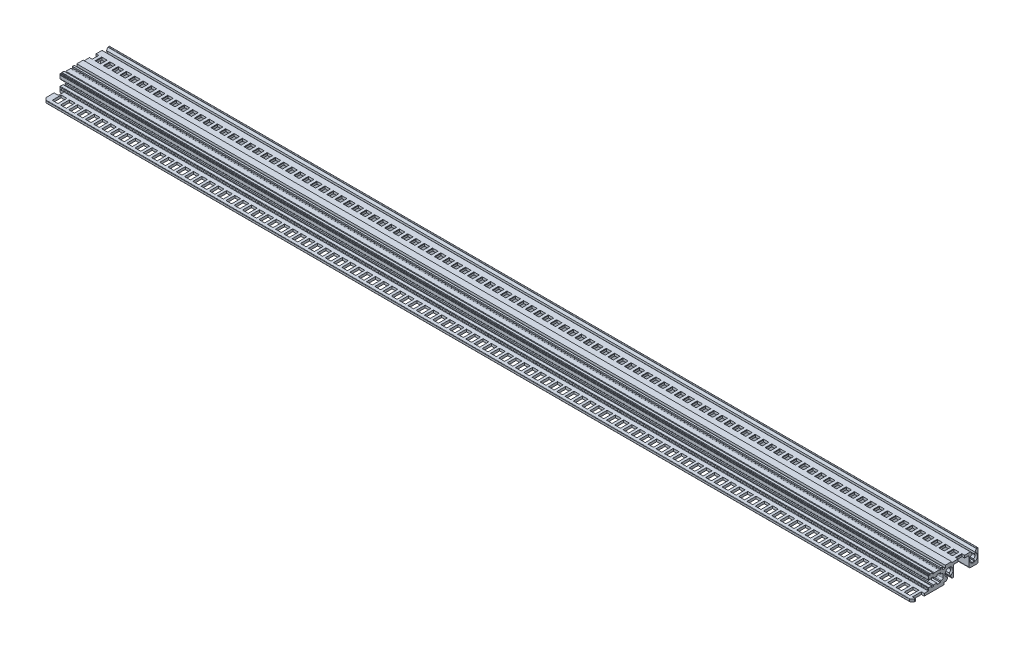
SolidWorks part; units mm, degrees
other "1"
ref_plane "前视基准面" through (0, 0, 0) normal (0, 0, 1) x (1, 0, 0)
ref_plane "上视基准面" through (0, 0, 0) normal (0, 1, 0) x (1, 0, 0)
ref_plane "右视基准面" through (0, 0, 0) normal (1, 0, 0) x (0, 0, -1)
imported_body "输入1"
sketch "草图1" plane through (215.9, 0, 0) normal (1, 0, 0) x (0, 0, -1)
  line L1 (-32.3698, 5.0331) -> (15.5626, 5.0331)
  line L2 (-32.3698, 5.0331) -> (-32.3698, -10.6403)
  line L3 (-32.3698, -10.6403) -> (15.5626, -10.6403)
  line L4 (15.5626, 5.0331) -> (15.5626, -10.6403)
extrude "切除-拉伸1" cut sketch "草图1" against normal up to surface (42.39 mm away)
sketch "草图2" plane through (173.51, 0, 0) normal (1, 0, 0) x (0, 0, -1)
  line L75 (-20.35, -7.9) -> (-30.05, -7.9)
  line L76 (-30.25, -8.1) -> (-30.25, -9.2)
  line L77 (-30.05, -9.4) -> (-10.9, -9.4)
  line L78 (-10.7, -9.2) -> (-10.7, -8.1)
  line L79 (-10.7, -8.1) -> (-9.2333, -8.1)
  line L80 (-9.0601, -8) -> (-8.425, -6.9)
  line L81 (-8.425, -6.9) -> (-8.425, -5.0408)
  line L82 (-8.425, -3.3592) -> (-8.425, -2.5571)
  line L83 (-8.075, -1.7) -> (-6.925, -1.7)
  line L84 (-6.575, -2.5571) -> (-6.575, -3.3592)
  line L85 (-6.575, -5.0408) -> (-6.575, -6.9)
  line L86 (-6.575, -6.9) -> (-5.7667, -8.3)
  line L87 (-5.5935, -8.4) -> (-4.95, -8.4)
  line L88 (-4.75, -8.2) -> (-4.75, -2.3)
  line L89 (-3.95, -1.5) -> (3.95, -1.5)
  line L90 (4.75, -2.3) -> (4.75, -7.6)
  line L91 (5.55, -8.4) -> (9.45, -8.4)
  line L92 (10.25, -7.6) -> (10.25, -0.2)
  line L93 (10.05, 0) -> (9.4065, 0)
  line L94 (9.2333, -0.1) -> (8.425, -1.5)
  line L95 (8.425, -1.5) -> (8.425, -3.3592)
  line L96 (8.425, -5.0408) -> (8.425, -6.2)
  line L97 (8.225, -6.4) -> (6.775, -6.4)
  line L98 (6.575, -6.2) -> (6.575, -5.0408)
  line L99 (6.575, -3.3592) -> (6.575, -1.5)
  line L100 (6.575, -1.5) -> (5.7667, -0.1)
  line L101 (5.5935, 0) -> (-5.95, 0)
  line L102 (-5.95, 0) -> (-5.95, 0.6)
  line L103 (-5.95, 0.6) -> (-9.85, 0.6)
  line L104 (-9.85, 0.6) -> (-9.85, -0.8)
  line L105 (-10.05, -1) -> (-11.25, -1)
  line L106 (-11.45, -0.8) -> (-11.45, 0.6)
  line L107 (-11.45, 0.6) -> (-12.5, 0.6)
  line L108 (-12.5, 0.6) -> (-12.5, -0.1)
  line L109 (-12.7, -0.3) -> (-13.3, -0.3)
  line L110 (-13.6873, 0) -> (-16.5127, 0)
  line L111 (-16.9, -0.3) -> (-17.5, -0.3)
  line L112 (-17.7, -0.1) -> (-17.7, 0.6)
  line L113 (-17.7, 0.6) -> (-18.95, 0.6)
  line L114 (-19.15, 0.4) -> (-19.15, 0.1)
  line L115 (-19.35, -0.1) -> (-19.45, -0.1)
  line L116 (-19.65, 0.1) -> (-19.65, 0.2)
  line L117 (-19.85, 0.4) -> (-19.95, 0.4)
  line L118 (-20.15, 0.2) -> (-20.15, 0.0328)
  line L119 (-20.2086, -0.1086) -> (-20.25, -0.15)
  line L120 (-20.25, -0.15) -> (-20.25, -1.95)
  line L121 (-20.25, -1.95) -> (-20.2086, -1.9914)
  line L122 (-20.15, -2.1328) -> (-20.15, -2.3)
  line L123 (-19.95, -2.5) -> (-19.85, -2.5)
  line L124 (-19.65, -2.3) -> (-19.65, -2.2)
  line L125 (-19.45, -2) -> (-19.2328, -2)
  line L126 (-19.0914, -2.0586) -> (-18.5086, -2.6414)
  line L127 (-18.3672, -2.7) -> (-18.25, -2.7)
  line L128 (-18.25, -2.7) -> (-18.25, -1.85)
  line L129 (-18.25, -1.85) -> (-17.05, -1.85)
  line L130 (-17.05, -1.85) -> (-17.05, -2.7)
  line L131 (-17.05, -2.7) -> (-15.05, -2.7)
  line L132 (-15.05, -2.7) -> (-15.05, -1.85)
  line L133 (-15.05, -1.85) -> (-12.85, -1.85)
  line L134 (-12.85, -1.85) -> (-12.85, -2.7)
  line L135 (-12.85, -2.7) -> (-12.05, -2.7)
  line L136 (-11.25, -3.5) -> (-11.25, -5.45)
  line L137 (-12.05, -6.25) -> (-12.85, -6.25)
  line L138 (-12.85, -6.25) -> (-12.85, -7.1)
  line L139 (-12.85, -7.1) -> (-15.05, -7.1)
  line L140 (-15.05, -7.1) -> (-15.05, -6.25)
  line L141 (-15.05, -6.25) -> (-17.05, -6.25)
  line L142 (-17.05, -6.25) -> (-17.05, -7.1)
  line L143 (-17.05, -7.1) -> (-18.25, -7.1)
  line L144 (-18.25, -7.1) -> (-18.25, -6.25)
  line L145 (-18.25, -6.25) -> (-19.9587, -6.25)
  line L146 (-20.2086, -6.5086) -> (-20.25, -6.55)
  line L147 (-20.25, -6.55) -> (-20.25, -7.28)
  line L148 (-20.25, -7.28) -> (-20.2086, -7.3214)
  line L149 (-20.15, -7.4628) -> (-20.15, -7.7)
  line L150 (-20.35, -7.9) -> (-30.05, -7.9)
  line L151 (-30.25, -8.1) -> (-30.25, -9.2)
  line L152 (-30.05, -9.4) -> (-10.9, -9.4)
  line L153 (-10.7, -9.2) -> (-10.7, -8.1)
  line L154 (-10.7, -8.1) -> (-9.2333, -8.1)
  line L155 (-9.0601, -8) -> (-8.425, -6.9)
  line L156 (-8.425, -6.9) -> (-8.425, -5.0408)
  line L157 (-8.425, -3.3592) -> (-8.425, -2.5571)
  line L158 (-8.075, -1.7) -> (-6.925, -1.7)
  line L159 (-6.575, -2.5571) -> (-6.575, -3.3592)
  line L160 (-6.575, -5.0408) -> (-6.575, -6.9)
  line L161 (-6.575, -6.9) -> (-5.7667, -8.3)
  line L162 (-5.5935, -8.4) -> (-4.95, -8.4)
  line L163 (-4.75, -8.2) -> (-4.75, -2.3)
  line L164 (-3.95, -1.5) -> (3.95, -1.5)
  line L165 (4.75, -2.3) -> (4.75, -7.6)
  line L166 (5.55, -8.4) -> (9.45, -8.4)
  line L167 (10.25, -7.6) -> (10.25, -0.2)
  line L168 (10.05, 0) -> (9.4065, 0)
  line L169 (9.2333, -0.1) -> (8.425, -1.5)
  line L170 (8.425, -1.5) -> (8.425, -3.3592)
  line L171 (8.425, -5.0408) -> (8.425, -6.2)
  line L172 (8.225, -6.4) -> (6.775, -6.4)
  line L173 (6.575, -6.2) -> (6.575, -5.0408)
  line L174 (6.575, -3.3592) -> (6.575, -1.5)
  line L175 (6.575, -1.5) -> (5.7667, -0.1)
  line L176 (5.5935, 0) -> (-5.95, 0)
  line L177 (-5.95, 0) -> (-5.95, 0.6)
  line L178 (-5.95, 0.6) -> (-9.85, 0.6)
  line L179 (-9.85, 0.6) -> (-9.85, -0.8)
  line L180 (-10.05, -1) -> (-11.25, -1)
  line L181 (-11.45, -0.8) -> (-11.45, 0.6)
  line L182 (-11.45, 0.6) -> (-12.5, 0.6)
  line L183 (-12.5, 0.6) -> (-12.5, -0.1)
  line L184 (-12.7, -0.3) -> (-13.3, -0.3)
  line L185 (-13.6873, 0) -> (-16.5127, 0)
  line L186 (-16.9, -0.3) -> (-17.5, -0.3)
  line L187 (-17.7, -0.1) -> (-17.7, 0.6)
  line L188 (-17.7, 0.6) -> (-18.95, 0.6)
  line L189 (-19.15, 0.4) -> (-19.15, 0.1)
  line L190 (-19.35, -0.1) -> (-19.45, -0.1)
  line L191 (-19.65, 0.1) -> (-19.65, 0.2)
  line L192 (-19.85, 0.4) -> (-19.95, 0.4)
  line L193 (-20.15, 0.2) -> (-20.15, 0.0328)
  line L194 (-20.2086, -0.1086) -> (-20.25, -0.15)
  line L195 (-20.25, -0.15) -> (-20.25, -1.95)
  line L196 (-20.25, -1.95) -> (-20.2086, -1.9914)
  line L197 (-20.15, -2.1328) -> (-20.15, -2.3)
  line L198 (-19.95, -2.5) -> (-19.85, -2.5)
  line L199 (-19.65, -2.3) -> (-19.65, -2.2)
  line L200 (-19.45, -2) -> (-19.2328, -2)
  line L201 (-19.0914, -2.0586) -> (-18.5086, -2.6414)
  line L202 (-18.3672, -2.7) -> (-18.25, -2.7)
  line L203 (-18.25, -2.7) -> (-18.25, -1.85)
  line L204 (-18.25, -1.85) -> (-17.05, -1.85)
  line L205 (-17.05, -1.85) -> (-17.05, -2.7)
  line L206 (-17.05, -2.7) -> (-15.05, -2.7)
  line L207 (-15.05, -2.7) -> (-15.05, -1.85)
  line L208 (-15.05, -1.85) -> (-12.85, -1.85)
  line L209 (-12.85, -1.85) -> (-12.85, -2.7)
  line L210 (-12.85, -2.7) -> (-12.05, -2.7)
  line L211 (-11.25, -3.5) -> (-11.25, -5.45)
  line L212 (-12.05, -6.25) -> (-12.85, -6.25)
  line L213 (-12.85, -6.25) -> (-12.85, -7.1)
  line L214 (-12.85, -7.1) -> (-15.05, -7.1)
  line L215 (-15.05, -7.1) -> (-15.05, -6.25)
  line L216 (-15.05, -6.25) -> (-17.05, -6.25)
  line L217 (-17.05, -6.25) -> (-17.05, -7.1)
  line L218 (-17.05, -7.1) -> (-18.25, -7.1)
  line L219 (-18.25, -7.1) -> (-18.25, -6.25)
  line L220 (-18.25, -6.25) -> (-19.9587, -6.25)
  line L221 (-20.2086, -6.5086) -> (-20.25, -6.55)
  line L222 (-20.25, -6.55) -> (-20.25, -7.28)
  line L223 (-20.25, -7.28) -> (-20.2086, -7.3214)
  line L224 (-20.15, -7.4628) -> (-20.15, -7.7)
  arc A47 (-30.05, -7.9) -> (-30.25, -8.1) centre (-30.05, -8.1) ccw
  arc A48 (-30.25, -9.2) -> (-30.05, -9.4) centre (-30.05, -9.2) ccw
  arc A49 (-10.9, -9.4) -> (-10.7, -9.2) centre (-10.9, -9.2) ccw
  arc A50 (-9.2333, -8.1) -> (-9.0601, -8) centre (-9.2333, -7.9) ccw
  arc A51 (-8.425, -3.3592) -> (-8.425, -5.0408) centre (-7.5, -4.2) ccw
  arc A52 (-8.075, -1.7) -> (-8.425, -2.5571) centre (-8.075, -2.2) ccw
  arc A53 (-6.575, -2.5571) -> (-6.925, -1.7) centre (-6.925, -2.2) ccw
  arc A54 (-6.575, -5.0408) -> (-6.575, -3.3592) centre (-7.5, -4.2) ccw
  arc A55 (-5.7667, -8.3) -> (-5.5935, -8.4) centre (-5.5935, -8.2) ccw
  arc A56 (-4.95, -8.4) -> (-4.75, -8.2) centre (-4.95, -8.2) ccw
  arc A57 (-3.95, -1.5) -> (-4.75, -2.3) centre (-3.95, -2.3) ccw
  arc A58 (4.75, -2.3) -> (3.95, -1.5) centre (3.95, -2.3) ccw
  arc A59 (4.75, -7.6) -> (5.55, -8.4) centre (5.55, -7.6) ccw
  arc A60 (9.45, -8.4) -> (10.25, -7.6) centre (9.45, -7.6) ccw
  arc A61 (10.25, -0.2) -> (10.05, 0) centre (10.05, -0.2) ccw
  arc A62 (9.4065, 0) -> (9.2333, -0.1) centre (9.4065, -0.2) ccw
  arc A63 (8.425, -5.0408) -> (8.425, -3.3592) centre (7.5, -4.2) ccw
  arc A64 (8.225, -6.4) -> (8.425, -6.2) centre (8.225, -6.2) ccw
  arc A65 (6.575, -6.2) -> (6.775, -6.4) centre (6.775, -6.2) ccw
  arc A66 (6.575, -3.3592) -> (6.575, -5.0408) centre (7.5, -4.2) ccw
  arc A67 (5.7667, -0.1) -> (5.5935, 0) centre (5.5935, -0.2) ccw
  arc A68 (-10.05, -1) -> (-9.85, -0.8) centre (-10.05, -0.8) ccw
  arc A69 (-11.45, -0.8) -> (-11.25, -1) centre (-11.25, -0.8) ccw
  arc A70 (-12.7, -0.3) -> (-12.5, -0.1) centre (-12.7, -0.1) ccw
  arc A71 (-13.4936, -0.15) -> (-13.3, -0.3) centre (-13.3, -0.1) ccw
  arc A72 (-13.4936, -0.15) -> (-13.6873, 0) centre (-13.6873, -0.2) ccw
  arc A73 (-16.5127, 0) -> (-16.7064, -0.15) centre (-16.5127, -0.2) ccw
  arc A74 (-16.9, -0.3) -> (-16.7064, -0.15) centre (-16.9, -0.1) ccw
  arc A75 (-17.7, -0.1) -> (-17.5, -0.3) centre (-17.5, -0.1) ccw
  arc A76 (-18.95, 0.6) -> (-19.15, 0.4) centre (-18.95, 0.4) ccw
  arc A77 (-19.35, -0.1) -> (-19.15, 0.1) centre (-19.35, 0.1) ccw
  arc A78 (-19.65, 0.1) -> (-19.45, -0.1) centre (-19.45, 0.1) ccw
  arc A79 (-19.65, 0.2) -> (-19.85, 0.4) centre (-19.85, 0.2) ccw
  arc A80 (-19.95, 0.4) -> (-20.15, 0.2) centre (-19.95, 0.2) ccw
  arc A81 (-20.2086, -0.1086) -> (-20.15, 0.0328) centre (-20.35, 0.0328) ccw
  arc A82 (-20.15, -2.1328) -> (-20.2086, -1.9914) centre (-20.35, -2.1328) ccw
  arc A83 (-20.15, -2.3) -> (-19.95, -2.5) centre (-19.95, -2.3) ccw
  arc A84 (-19.85, -2.5) -> (-19.65, -2.3) centre (-19.85, -2.3) ccw
  arc A85 (-19.45, -2) -> (-19.65, -2.2) centre (-19.45, -2.2) ccw
  arc A86 (-19.0914, -2.0586) -> (-19.2328, -2) centre (-19.2328, -2.2) ccw
  arc A87 (-18.5086, -2.6414) -> (-18.3672, -2.7) centre (-18.3672, -2.5) ccw
  arc A88 (-11.25, -3.5) -> (-12.05, -2.7) centre (-12.05, -3.5) ccw
  arc A89 (-12.05, -6.25) -> (-11.25, -5.45) centre (-12.05, -5.45) ccw
  arc A90 (-19.9587, -6.25) -> (-20.1543, -6.4086) centre (-19.9587, -6.45) ccw
  arc A91 (-20.2086, -6.5086) -> (-20.1543, -6.4086) centre (-20.35, -6.3672) ccw
  arc A92 (-20.15, -7.4628) -> (-20.2086, -7.3214) centre (-20.35, -7.4628) ccw
  arc A93 (-20.35, -7.9) -> (-20.15, -7.7) centre (-20.35, -7.7) ccw
  arc A94 (-30.05, -7.9) -> (-30.25, -8.1) centre (-30.05, -8.1) ccw
  arc A95 (-30.25, -9.2) -> (-30.05, -9.4) centre (-30.05, -9.2) ccw
  arc A96 (-10.9, -9.4) -> (-10.7, -9.2) centre (-10.9, -9.2) ccw
  arc A97 (-9.2333, -8.1) -> (-9.0601, -8) centre (-9.2333, -7.9) ccw
  arc A98 (-8.425, -3.3592) -> (-8.425, -5.0408) centre (-7.5, -4.2) ccw
  arc A99 (-8.075, -1.7) -> (-8.425, -2.5571) centre (-8.075, -2.2) ccw
  arc A100 (-6.575, -2.5571) -> (-6.925, -1.7) centre (-6.925, -2.2) ccw
  arc A101 (-6.575, -5.0408) -> (-6.575, -3.3592) centre (-7.5, -4.2) ccw
  arc A102 (-5.7667, -8.3) -> (-5.5935, -8.4) centre (-5.5935, -8.2) ccw
  arc A103 (-4.95, -8.4) -> (-4.75, -8.2) centre (-4.95, -8.2) ccw
  arc A104 (-3.95, -1.5) -> (-4.75, -2.3) centre (-3.95, -2.3) ccw
  arc A105 (4.75, -2.3) -> (3.95, -1.5) centre (3.95, -2.3) ccw
  arc A106 (4.75, -7.6) -> (5.55, -8.4) centre (5.55, -7.6) ccw
  arc A107 (9.45, -8.4) -> (10.25, -7.6) centre (9.45, -7.6) ccw
  arc A108 (10.25, -0.2) -> (10.05, 0) centre (10.05, -0.2) ccw
  arc A109 (9.4065, 0) -> (9.2333, -0.1) centre (9.4065, -0.2) ccw
  arc A110 (8.425, -5.0408) -> (8.425, -3.3592) centre (7.5, -4.2) ccw
  arc A111 (8.225, -6.4) -> (8.425, -6.2) centre (8.225, -6.2) ccw
  arc A112 (6.575, -6.2) -> (6.775, -6.4) centre (6.775, -6.2) ccw
  arc A113 (6.575, -3.3592) -> (6.575, -5.0408) centre (7.5, -4.2) ccw
  arc A114 (5.7667, -0.1) -> (5.5935, 0) centre (5.5935, -0.2) ccw
  arc A115 (-10.05, -1) -> (-9.85, -0.8) centre (-10.05, -0.8) ccw
  arc A116 (-11.45, -0.8) -> (-11.25, -1) centre (-11.25, -0.8) ccw
  arc A117 (-12.7, -0.3) -> (-12.5, -0.1) centre (-12.7, -0.1) ccw
  arc A118 (-13.4936, -0.15) -> (-13.3, -0.3) centre (-13.3, -0.1) ccw
  arc A119 (-13.4936, -0.15) -> (-13.6873, 0) centre (-13.6873, -0.2) ccw
  arc A120 (-16.5127, 0) -> (-16.7064, -0.15) centre (-16.5127, -0.2) ccw
  arc A121 (-16.9, -0.3) -> (-16.7064, -0.15) centre (-16.9, -0.1) ccw
  arc A122 (-17.7, -0.1) -> (-17.5, -0.3) centre (-17.5, -0.1) ccw
  arc A123 (-18.95, 0.6) -> (-19.15, 0.4) centre (-18.95, 0.4) ccw
  arc A124 (-19.35, -0.1) -> (-19.15, 0.1) centre (-19.35, 0.1) ccw
  arc A125 (-19.65, 0.1) -> (-19.45, -0.1) centre (-19.45, 0.1) ccw
  arc A126 (-19.65, 0.2) -> (-19.85, 0.4) centre (-19.85, 0.2) ccw
  arc A127 (-19.95, 0.4) -> (-20.15, 0.2) centre (-19.95, 0.2) ccw
  arc A128 (-20.2086, -0.1086) -> (-20.15, 0.0328) centre (-20.35, 0.0328) ccw
  arc A129 (-20.15, -2.1328) -> (-20.2086, -1.9914) centre (-20.35, -2.1328) ccw
  arc A130 (-20.15, -2.3) -> (-19.95, -2.5) centre (-19.95, -2.3) ccw
  arc A131 (-19.85, -2.5) -> (-19.65, -2.3) centre (-19.85, -2.3) ccw
  arc A132 (-19.45, -2) -> (-19.65, -2.2) centre (-19.45, -2.2) ccw
  arc A133 (-19.0914, -2.0586) -> (-19.2328, -2) centre (-19.2328, -2.2) ccw
  arc A134 (-18.5086, -2.6414) -> (-18.3672, -2.7) centre (-18.3672, -2.5) ccw
  arc A135 (-11.25, -3.5) -> (-12.05, -2.7) centre (-12.05, -3.5) ccw
  arc A136 (-12.05, -6.25) -> (-11.25, -5.45) centre (-12.05, -5.45) ccw
  arc A137 (-19.9587, -6.25) -> (-20.1543, -6.4086) centre (-19.9587, -6.45) ccw
  arc A138 (-20.2086, -6.5086) -> (-20.1543, -6.4086) centre (-20.35, -6.3672) ccw
  arc A139 (-20.15, -7.4628) -> (-20.2086, -7.3214) centre (-20.35, -7.4628) ccw
  arc A140 (-20.35, -7.9) -> (-20.15, -7.7) centre (-20.35, -7.7) ccw
  dimension "D1" = 0
extrude "凸台-拉伸1" add sketch "草图2" along normal blind 143.99
sketch "草图3" plane through (317.5, 0, 0) normal (1, 0, 0) x (0, 0, -1)
  circle A0 centre (-7.5, -4.2) radius 1.65
  circle A1 centre (7.5, -4.2) radius 1.65
extrude "切除-拉伸2" cut sketch "草图3" against normal blind 15.02
chamfer "倒角1" distance 0.85 angle 45 3 edges at (317.5, -4.2, -5.85) (317.5, -4.2, 5.85) (317.5, -4.2, 9.15)
sketch "草图4" plane through (0, -7.9, 0) normal (0, 1, 0) x (1, 0, 0)
  line L1 (173.51, -22.75) -> (177.01, -22.75)
  line L2 (173.51, -22.75) -> (173.51, -28.25)
  line L3 (173.51, -28.25) -> (177.01, -28.25)
  line L4 (177.01, -22.75) -> (177.01, -28.25)
  line L6 (171.93, -22.75) -> (171.93, -28.25) construction
  line L8 (178.59, -28.25) -> (182.09, -28.25)
  line L9 (178.59, -22.75) -> (178.59, -28.25)
  line L10 (178.59, -22.75) -> (182.09, -22.75)
  line L11 (182.09, -22.75) -> (182.09, -28.25)
  line L12 (183.67, -28.25) -> (187.17, -28.25)
  line L13 (183.67, -22.75) -> (183.67, -28.25)
  line L14 (183.67, -22.75) -> (187.17, -22.75)
  line L15 (187.17, -22.75) -> (187.17, -28.25)
  line L16 (188.75, -28.25) -> (192.25, -28.25)
  line L17 (188.75, -22.75) -> (188.75, -28.25)
  line L18 (188.75, -22.75) -> (192.25, -22.75)
  line L19 (192.25, -22.75) -> (192.25, -28.25)
  line L20 (193.83, -28.25) -> (197.33, -28.25)
  line L21 (193.83, -22.75) -> (193.83, -28.25)
  line L22 (193.83, -22.75) -> (197.33, -22.75)
  line L23 (197.33, -22.75) -> (197.33, -28.25)
  line L24 (198.91, -28.25) -> (202.41, -28.25)
  line L25 (198.91, -22.75) -> (198.91, -28.25)
  line L26 (198.91, -22.75) -> (202.41, -22.75)
  line L27 (202.41, -22.75) -> (202.41, -28.25)
  line L28 (203.99, -28.25) -> (207.49, -28.25)
  line L29 (203.99, -22.75) -> (203.99, -28.25)
  line L30 (203.99, -22.75) -> (207.49, -22.75)
  line L31 (207.49, -22.75) -> (207.49, -28.25)
  line L32 (209.07, -28.25) -> (212.57, -28.25)
  line L33 (209.07, -22.75) -> (209.07, -28.25)
  line L34 (209.07, -22.75) -> (212.57, -22.75)
  line L35 (212.57, -22.75) -> (212.57, -28.25)
  line L36 (214.15, -28.25) -> (217.65, -28.25)
  line L37 (214.15, -22.75) -> (214.15, -28.25)
  line L38 (214.15, -22.75) -> (217.65, -22.75)
  line L39 (217.65, -22.75) -> (217.65, -28.25)
  line L40 (219.23, -28.25) -> (222.73, -28.25)
  line L41 (219.23, -22.75) -> (219.23, -28.25)
  line L42 (219.23, -22.75) -> (222.73, -22.75)
  line L43 (222.73, -22.75) -> (222.73, -28.25)
  line L44 (224.31, -28.25) -> (227.81, -28.25)
  line L45 (224.31, -22.75) -> (224.31, -28.25)
  line L46 (224.31, -22.75) -> (227.81, -22.75)
  line L47 (227.81, -22.75) -> (227.81, -28.25)
  line L48 (229.39, -28.25) -> (232.89, -28.25)
  line L49 (229.39, -22.75) -> (229.39, -28.25)
  line L50 (229.39, -22.75) -> (232.89, -22.75)
  line L51 (232.89, -22.75) -> (232.89, -28.25)
  line L52 (234.47, -28.25) -> (237.97, -28.25)
  line L53 (234.47, -22.75) -> (234.47, -28.25)
  line L54 (234.47, -22.75) -> (237.97, -22.75)
  line L55 (237.97, -22.75) -> (237.97, -28.25)
  line L56 (239.55, -28.25) -> (243.05, -28.25)
  line L57 (239.55, -22.75) -> (239.55, -28.25)
  line L58 (239.55, -22.75) -> (243.05, -22.75)
  line L59 (243.05, -22.75) -> (243.05, -28.25)
  line L60 (244.63, -28.25) -> (248.13, -28.25)
  line L61 (244.63, -22.75) -> (244.63, -28.25)
  line L62 (244.63, -22.75) -> (248.13, -22.75)
  line L63 (248.13, -22.75) -> (248.13, -28.25)
  line L64 (249.71, -28.25) -> (253.21, -28.25)
  line L65 (249.71, -22.75) -> (249.71, -28.25)
  line L66 (249.71, -22.75) -> (253.21, -22.75)
  line L67 (253.21, -22.75) -> (253.21, -28.25)
  line L68 (254.79, -28.25) -> (258.29, -28.25)
  line L69 (254.79, -22.75) -> (254.79, -28.25)
  line L70 (254.79, -22.75) -> (258.29, -22.75)
  line L71 (258.29, -22.75) -> (258.29, -28.25)
  line L72 (259.87, -28.25) -> (263.37, -28.25)
  line L73 (259.87, -22.75) -> (259.87, -28.25)
  line L74 (259.87, -22.75) -> (263.37, -22.75)
  line L75 (263.37, -22.75) -> (263.37, -28.25)
  line L76 (264.95, -28.25) -> (268.45, -28.25)
  line L77 (264.95, -22.75) -> (264.95, -28.25)
  line L78 (264.95, -22.75) -> (268.45, -22.75)
  line L79 (268.45, -22.75) -> (268.45, -28.25)
  line L80 (270.03, -28.25) -> (273.53, -28.25)
  line L81 (270.03, -22.75) -> (270.03, -28.25)
  line L82 (270.03, -22.75) -> (273.53, -22.75)
  line L83 (273.53, -22.75) -> (273.53, -28.25)
  line L84 (275.11, -28.25) -> (278.61, -28.25)
  line L85 (275.11, -22.75) -> (275.11, -28.25)
  line L86 (275.11, -22.75) -> (278.61, -22.75)
  line L87 (278.61, -22.75) -> (278.61, -28.25)
  line L88 (280.19, -28.25) -> (283.69, -28.25)
  line L89 (280.19, -22.75) -> (280.19, -28.25)
  line L90 (280.19, -22.75) -> (283.69, -22.75)
  line L91 (283.69, -22.75) -> (283.69, -28.25)
  line L92 (285.27, -28.25) -> (288.77, -28.25)
  line L93 (285.27, -22.75) -> (285.27, -28.25)
  line L94 (285.27, -22.75) -> (288.77, -22.75)
  line L95 (288.77, -22.75) -> (288.77, -28.25)
  line L96 (290.35, -28.25) -> (293.85, -28.25)
  line L97 (290.35, -22.75) -> (290.35, -28.25)
  line L98 (290.35, -22.75) -> (293.85, -22.75)
  line L99 (293.85, -22.75) -> (293.85, -28.25)
  line L100 (295.43, -28.25) -> (298.93, -28.25)
  line L101 (295.43, -22.75) -> (295.43, -28.25)
  line L102 (295.43, -22.75) -> (298.93, -22.75)
  line L103 (298.93, -22.75) -> (298.93, -28.25)
  line L104 (300.51, -28.25) -> (304.01, -28.25)
  line L105 (300.51, -22.75) -> (300.51, -28.25)
  line L106 (300.51, -22.75) -> (304.01, -22.75)
  line L107 (304.01, -22.75) -> (304.01, -28.25)
  line L108 (305.59, -28.25) -> (309.09, -28.25)
  line L109 (305.59, -22.75) -> (305.59, -28.25)
  line L110 (305.59, -22.75) -> (309.09, -22.75)
  line L111 (309.09, -22.75) -> (309.09, -28.25)
  line L112 (310.67, -28.25) -> (314.17, -28.25)
  line L113 (310.67, -22.75) -> (310.67, -28.25)
  line L114 (310.67, -22.75) -> (314.17, -22.75)
  line L115 (314.17, -22.75) -> (314.17, -28.25)
  line L116 (315.75, -28.25) -> (319.25, -28.25)
  line L117 (315.75, -22.75) -> (315.75, -28.25)
  line L118 (315.75, -22.75) -> (319.25, -22.75)
  line L119 (319.25, -22.75) -> (319.25, -28.25)
  dimension "D1" = 3.5
  dimension "D2" = 5.08
  dimension "D3" = 29
extrude "切除-拉伸3" cut sketch "草图4" against normal through all
sketch "草图5" plane through (0, 0, 0) normal (0, 1, 0) x (1, 0, 0)
  line L0 (171.68, 2) -> (171.68, -2) construction
  line L1 (173.76, 2) -> (176.76, 2)
  line L2 (173.76, 2) -> (173.76, -2)
  line L3 (173.76, -2) -> (176.76, -2)
  line L4 (176.76, 2) -> (176.76, -2)
  line L5 (178.84, -2) -> (181.84, -2)
  line L6 (178.84, 2) -> (178.84, -2)
  line L7 (178.84, 2) -> (181.84, 2)
  line L8 (181.84, 2) -> (181.84, -2)
  line L9 (183.92, -2) -> (186.92, -2)
  line L10 (183.92, 2) -> (183.92, -2)
  line L11 (183.92, 2) -> (186.92, 2)
  line L12 (186.92, 2) -> (186.92, -2)
  line L13 (189, -2) -> (192, -2)
  line L14 (189, 2) -> (189, -2)
  line L15 (189, 2) -> (192, 2)
  line L16 (192, 2) -> (192, -2)
  line L17 (194.08, -2) -> (197.08, -2)
  line L18 (194.08, 2) -> (194.08, -2)
  line L19 (194.08, 2) -> (197.08, 2)
  line L20 (197.08, 2) -> (197.08, -2)
  line L21 (199.16, -2) -> (202.16, -2)
  line L22 (199.16, 2) -> (199.16, -2)
  line L23 (199.16, 2) -> (202.16, 2)
  line L24 (202.16, 2) -> (202.16, -2)
  line L25 (204.24, -2) -> (207.24, -2)
  line L26 (204.24, 2) -> (204.24, -2)
  line L27 (204.24, 2) -> (207.24, 2)
  line L28 (207.24, 2) -> (207.24, -2)
  line L29 (209.32, -2) -> (212.32, -2)
  line L30 (209.32, 2) -> (209.32, -2)
  line L31 (209.32, 2) -> (212.32, 2)
  line L32 (212.32, 2) -> (212.32, -2)
  line L33 (214.4, -2) -> (217.4, -2)
  line L34 (214.4, 2) -> (214.4, -2)
  line L35 (214.4, 2) -> (217.4, 2)
  line L36 (217.4, 2) -> (217.4, -2)
  line L37 (219.48, -2) -> (222.48, -2)
  line L38 (219.48, 2) -> (219.48, -2)
  line L39 (219.48, 2) -> (222.48, 2)
  line L40 (222.48, 2) -> (222.48, -2)
  line L41 (224.56, -2) -> (227.56, -2)
  line L42 (224.56, 2) -> (224.56, -2)
  line L43 (224.56, 2) -> (227.56, 2)
  line L44 (227.56, 2) -> (227.56, -2)
  line L45 (229.64, -2) -> (232.64, -2)
  line L46 (229.64, 2) -> (229.64, -2)
  line L47 (229.64, 2) -> (232.64, 2)
  line L48 (232.64, 2) -> (232.64, -2)
  line L49 (234.72, -2) -> (237.72, -2)
  line L50 (234.72, 2) -> (234.72, -2)
  line L51 (234.72, 2) -> (237.72, 2)
  line L52 (237.72, 2) -> (237.72, -2)
  line L53 (239.8, -2) -> (242.8, -2)
  line L54 (239.8, 2) -> (239.8, -2)
  line L55 (239.8, 2) -> (242.8, 2)
  line L56 (242.8, 2) -> (242.8, -2)
  line L57 (244.88, -2) -> (247.88, -2)
  line L58 (244.88, 2) -> (244.88, -2)
  line L59 (244.88, 2) -> (247.88, 2)
  line L60 (247.88, 2) -> (247.88, -2)
  line L61 (249.96, -2) -> (252.96, -2)
  line L62 (249.96, 2) -> (249.96, -2)
  line L63 (249.96, 2) -> (252.96, 2)
  line L64 (252.96, 2) -> (252.96, -2)
  line L65 (255.04, -2) -> (258.04, -2)
  line L66 (255.04, 2) -> (255.04, -2)
  line L67 (255.04, 2) -> (258.04, 2)
  line L68 (258.04, 2) -> (258.04, -2)
  line L69 (260.12, -2) -> (263.12, -2)
  line L70 (260.12, 2) -> (260.12, -2)
  line L71 (260.12, 2) -> (263.12, 2)
  line L72 (263.12, 2) -> (263.12, -2)
  line L73 (265.2, -2) -> (268.2, -2)
  line L74 (265.2, 2) -> (265.2, -2)
  line L75 (265.2, 2) -> (268.2, 2)
  line L76 (268.2, 2) -> (268.2, -2)
  line L77 (270.28, -2) -> (273.28, -2)
  line L78 (270.28, 2) -> (270.28, -2)
  line L79 (270.28, 2) -> (273.28, 2)
  line L80 (273.28, 2) -> (273.28, -2)
  line L81 (275.36, -2) -> (278.36, -2)
  line L82 (275.36, 2) -> (275.36, -2)
  line L83 (275.36, 2) -> (278.36, 2)
  line L84 (278.36, 2) -> (278.36, -2)
  line L85 (280.44, -2) -> (283.44, -2)
  line L86 (280.44, 2) -> (280.44, -2)
  line L87 (280.44, 2) -> (283.44, 2)
  line L88 (283.44, 2) -> (283.44, -2)
  line L89 (285.52, -2) -> (288.52, -2)
  line L90 (285.52, 2) -> (285.52, -2)
  line L91 (285.52, 2) -> (288.52, 2)
  line L92 (288.52, 2) -> (288.52, -2)
  line L93 (290.6, -2) -> (293.6, -2)
  line L94 (290.6, 2) -> (290.6, -2)
  line L95 (290.6, 2) -> (293.6, 2)
  line L96 (293.6, 2) -> (293.6, -2)
  line L97 (295.68, -2) -> (298.68, -2)
  line L98 (295.68, 2) -> (295.68, -2)
  line L99 (295.68, 2) -> (298.68, 2)
  line L100 (298.68, 2) -> (298.68, -2)
  line L101 (300.76, -2) -> (303.76, -2)
  line L102 (300.76, 2) -> (300.76, -2)
  line L103 (300.76, 2) -> (303.76, 2)
  line L104 (303.76, 2) -> (303.76, -2)
  line L105 (305.84, -2) -> (308.84, -2)
  line L106 (305.84, 2) -> (305.84, -2)
  line L107 (305.84, 2) -> (308.84, 2)
  line L108 (308.84, 2) -> (308.84, -2)
  line L109 (310.92, -2) -> (313.92, -2)
  line L110 (310.92, 2) -> (310.92, -2)
  line L111 (310.92, 2) -> (313.92, 2)
  line L112 (313.92, 2) -> (313.92, -2)
  line L113 (316, -2) -> (319, -2)
  line L114 (316, 2) -> (316, -2)
  line L115 (316, 2) -> (319, 2)
  line L116 (319, 2) -> (319, -2)
  dimension "D1" = 3
  dimension "D2" = 5.08
  dimension "D3" = 29
extrude "切除-拉伸4" cut sketch "草图5" against normal through all
chamfer "倒角2" distance 0.17 distance2 0.3 57 edges at (316, 0, 0) (313.92, 0, 0) (310.92, 0, 0) (308.84, 0, 0) (305.84, 0, 0) (303.76, 0, 0) (300.76, 0, 0) (298.68, 0, 0) (295.68, 0, 0) (293.6, 0, 0) (290.6, 0, 0) (288.52, 0, 0) (285.52, 0, 0) (283.44, 0, 0) (280.44, 0, 0) (278.36, 0, 0) (275.36, 0, 0) (273.28, 0, 0) (270.28, 0, 0) (268.2, 0, 0) (265.2, 0, 0) (263.12, 0, 0) (260.12, 0, 0) (258.04, 0, 0) (255.04, 0, 0) (252.96, 0, 0) (249.96, 0, 0) (247.88, 0, 0) (244.88, 0, 0) (242.8, 0, 0) (239.8, 0, 0) (237.72, 0, 0) (234.72, 0, 0) (232.64, 0, 0) (229.64, 0, 0) (224.56, 0, 0) (227.56, 0, 0) (222.48, 0, 0) (219.48, 0, 0) (217.4, 0, 0) (214.4, 0, 0) (212.32, 0, 0) (209.32, 0, 0) (207.24, 0, 0) (204.24, 0, 0) (202.16, 0, 0) (199.16, 0, 0) (197.08, 0, 0) (194.08, 0, 0) (192, 0, 0) (189, 0, 0) (186.92, 0, 0) (183.92, 0, 0) (181.84, 0, 0) (178.84, 0, 0) (176.76, 0, 0) (173.76, 0, 0)
sketch "草图6" plane through (0, -7.9, 0) normal (0, 1, 0) x (1, 0, 0)
  line L0 (317.5, -28.75) -> (316, -30.25)
  line L1 (317.5, -30.25) -> (316, -30.25)
  line L2 (317.5, -30.25) -> (317.5, -28.75)
  dimension "D1" = 1.5
  dimension "D2" = 1.5
extrude "切除-拉伸5" cut sketch "草图6" against normal through all
